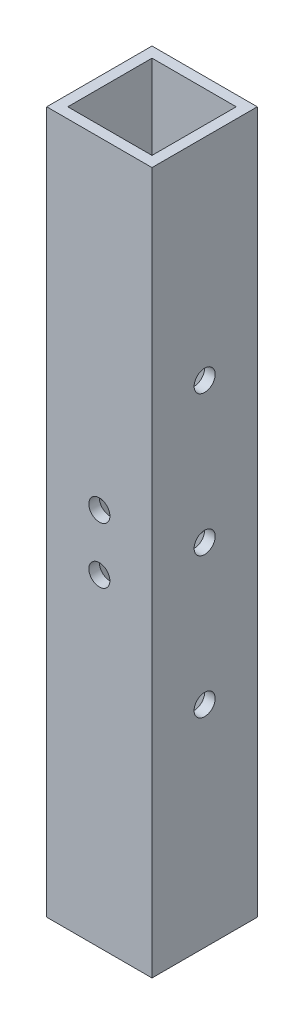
SolidWorks part; units mm, degrees
ref_plane "Front" through (0, 0, 0) normal (0, 0, 1) x (1, 0, 0)
ref_plane "Top" through (0, 0, 0) normal (0, 1, 0) x (1, 0, 0)
ref_plane "Right" through (0, 0, 0) normal (1, 0, 0) x (0, 0, -1)
sketch "草图1" plane through (0, 0, 0) normal (0, 1, 0) x (1, 0, 0)
  line L0 (1.5, 1.5) -> (13.5, 1.5)
  line L1 (0, 0) -> (15, 0)
  line L2 (0, 0) -> (0, 15)
  line L3 (0, 15) -> (15, 15)
  line L4 (15, 0) -> (15, 15)
  line L5 (13.5, 1.5) -> (13.5, 13.5)
  line L6 (1.5, 13.5) -> (13.5, 13.5)
  line L7 (1.5, 1.5) -> (1.5, 13.5)
  dimension "D1" = 15
  dimension "D2" = 15
  dimension "D3" = 1.5
extrude "凸台-拉伸1" add sketch "草图1" along normal blind 100
sketch "草图2" plane through (0, 0, 0) normal (0, 0, 1) x (1, 0, 0)
  line L2 (0, 100) -> (0, 0) construction
  line L3 (15, 100) -> (15, 0) construction
  circle A0 centre (7.5, 54) radius 1.5
  circle A1 centre (7.5, 46) radius 1.5
  point P4 (0, 0)
  point P5 (15, 50)
  dimension "D1" = 4
  dimension "D3" = 3
  dimension "D4" = 8
  dimension "D6" = 3
  dimension "D5" = 7.5
extrude "切除-拉伸1" cut sketch "草图2" against normal up to surface (15 mm away)
hole_wizard "Ø3.0 (3) 直径孔1" positions "草图3" profile "草图4" hole size "Ø3.0" standard "GB"
sketch "草图3" plane through (15, 0, 0) normal (1, 0, 0) x (0, 0, -1)
  line L0 (0, 100) -> (0, 0) construction
  point P0 (7.5, 70)
  point P2 (7.5, 30)
  point P8 (0, 50)
  dimension "D1" = 7.5
  dimension "D2" = 7.5
  dimension "D3" = 40
  dimension "D4" = 20
sketch "草图4" plane through (15, 70, -7.5) normal (0, 1, 0) x (0, 0, -1)
  line L0 (0, 0) -> (0, 15)
  line L1 (0, 15) -> (1.5, 15)
  line L2 (1.5, 15) -> (1.5, 0)
  line L5 (1.5, 0) -> (0, 0)
  line L11 (0, -6.35) -> (0, 107.95) construction
  dimension "通孔孔直径" = 3
  dimension "通孔孔深度" = 15
hole_wizard "Ø3.0 (3) 直径孔2" positions "草图5" profile "草图6" hole size "Ø3.0" standard "GB"
sketch "草图5" plane through (15, 0, 0) normal (1, 0, 0) x (0, 0, -1)
  line L0 (15, 100) -> (15, 0) construction
  point P0 (7.5, 50)
  point P5 (15, 50)
  dimension "D1" = 7.5
  dimension "D2" = 0
sketch "草图6" plane through (15, 50, -7.5) normal (0, 1, 0) x (0, 0, -1)
  line L0 (0, 0) -> (0, 15)
  line L1 (0, 15) -> (1.5, 15)
  line L2 (1.5, 15) -> (1.5, 0)
  line L5 (1.5, 0) -> (0, 0)
  line L11 (0, -6.35) -> (0, 107.95) construction
  dimension "通孔孔直径" = 3
  dimension "通孔孔深度" = 15
